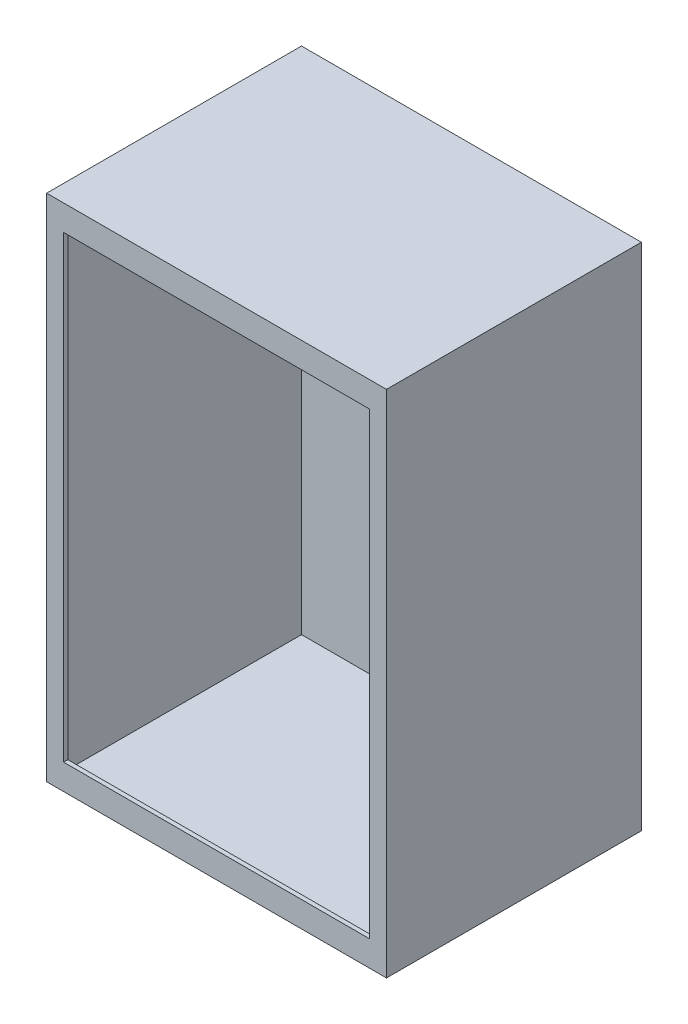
SolidWorks part; units mm, degrees
ref_plane "正面" through (0, 0, 0) normal (0, 0, 1) x (1, 0, 0)
ref_plane "平面" through (0, 0, 0) normal (0, 1, 0) x (1, 0, 0)
ref_plane "右側面" through (0, 0, 0) normal (1, 0, 0) x (0, 0, -1)
sketch "ｽｹｯﾁ1" plane through (0, 0, 0) normal (0, 0, 1) x (1, 0, 0)
  line L1 (0, 0) -> (400, 0)
  line L2 (0, 0) -> (0, 600)
  line L3 (0, 600) -> (400, 600)
  line L4 (400, 0) -> (400, 600)
  dimension "D1" = 400
  dimension "D2" = 600
extrude "ﾎﾞｽ - 押し出し1" add sketch "ｽｹｯﾁ1" along normal blind 300
sketch "ｽｹｯﾁ2" plane through (0, 0, 300) normal (0, 0, -1) x (-1, 0, 0)
  line L0 (-400, 600) -> (0, 600) construction
  line L1 (-20, 570) -> (-380, 570)
  line L2 (-20, 570) -> (-20, 30)
  line L3 (-20, 30) -> (-380, 30)
  line L4 (-380, 570) -> (-380, 30)
  line L5 (-400, 0) -> (-400, 600) construction
  line L6 (0, 600) -> (0, 0) construction
  line L7 (0, 0) -> (-400, 0) construction
  dimension "D1" = 30
  dimension "D2" = 20
  dimension "D3" = 20
  dimension "D4" = 30
shell "ｼｪﾙ1" thickness 3
